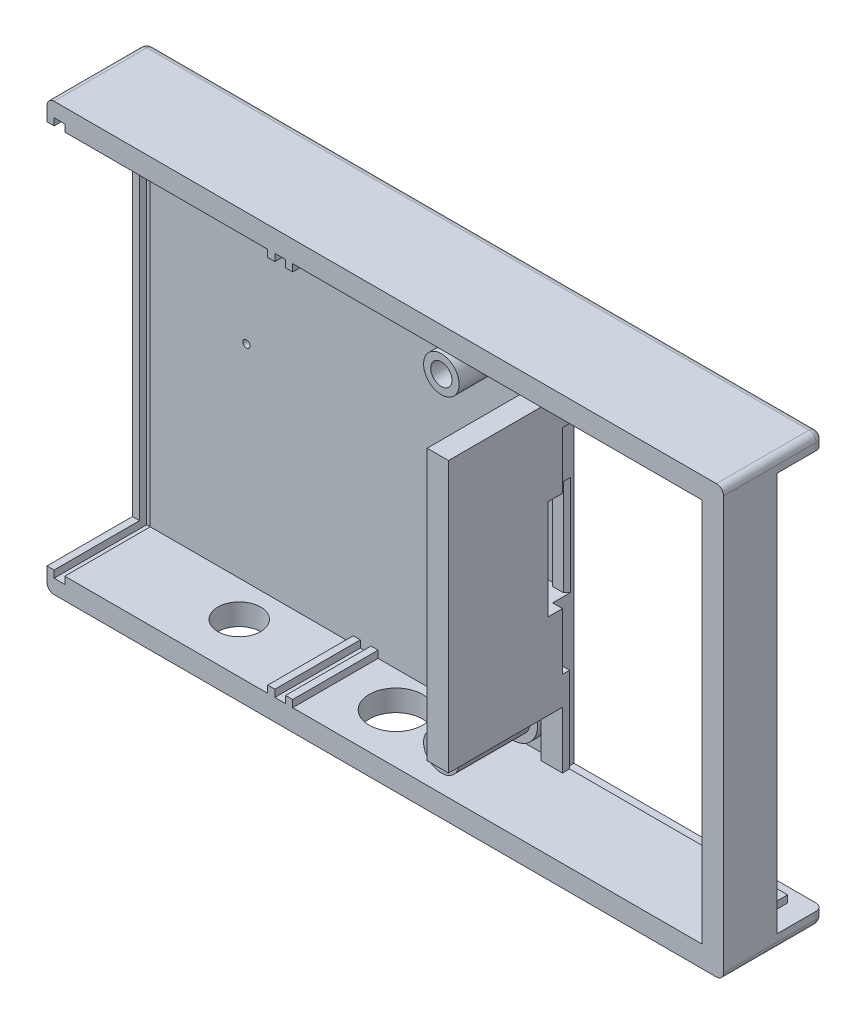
SolidWorks part; units mm, degrees
ref_plane "Plan1" through (0, 0, 0) normal (0, 0, 1) x (1, 0, 0)
ref_plane "Plan2" through (0, 0, 0) normal (0, 1, 0) x (1, 0, 0)
ref_plane "Plan3" through (0, 0, 0) normal (1, 0, 0) x (0, 0, -1)
sketch "Esquisse1" plane through (0, 0, 0) normal (0, 0, 1) x (1, 0, 0)
  line L1 (-60, 40) -> (35, 40)
  line L2 (-60, 40) -> (-60, -20)
  line L3 (-60, -20) -> (35, -20)
  line L4 (35, 40) -> (35, -20)
  dimension "D1" = 95
  dimension "D2" = 60
extrude "Base-Extrusion" add sketch "Esquisse1" along normal blind 14
sketch "Esquisse2" plane through (0, 0, 14) normal (0, 0, 1) x (1, 0, 0)
  line L0 (35, 40) -> (-60, 40) construction
  line L1 (-57, 37) -> (32, 37)
  line L2 (-57, 37) -> (-57, -17)
  line L3 (-57, -17) -> (32, -17)
  line L4 (32, 37) -> (32, -17)
  line L5 (-60, -20) -> (35, -20) construction
  line L6 (-60, 40) -> (-60, -20) construction
  line L7 (35, -20) -> (35, 40) construction
  dimension "D1" = 89
  dimension "D2" = 3
  dimension "D3" = 3
  dimension "D4" = 3
  dimension "D5" = 3
  dimension "D6" = 3
extrude "Enlèv. mat.-Extru.1" cut sketch "Esquisse2" against normal blind 12
sketch "Esquisse3" plane through (0, 0, 14) normal (0, 0, 1) x (1, 0, 0)
  line L0 (35, -20) -> (35, 40) construction
  line L1 (32, -17) -> (35, -17)
  line L2 (32, -17) -> (32, 37)
  line L3 (32, 37) -> (35, 37)
  line L4 (35, -17) -> (35, 37)
  dimension "D1" = 54
  dimension "D2" = 3
extrude "Enlèv. mat.-Extru.2" cut sketch "Esquisse3" against normal blind 12
sketch "Esquisse4" plane through (0, 0, 2) normal (0, 0, 1) x (1, 0, 0)
  line L0 (35, 37) -> (-57, 37) construction
  line L1 (0, 37) -> (32, 37)
  line L2 (0, 37) -> (0, -17)
  line L3 (0, -17) -> (32, -17)
  line L4 (32, 37) -> (32, -17)
  line L5 (35, -17) -> (35, 37) construction
  dimension "D1" = 3
  dimension "D2" = 32
extrude "Enlèv. mat.-Extru.3" cut sketch "Esquisse4" against normal through all
sketch "Esquisse12" plane through (0, 0, 0) normal (0, 0, -1) x (-1, 0, 0)
  line L1 (0, 37) -> (-2, 37)
  line L2 (0, 37) -> (0, 38)
  line L3 (0, 38) -> (-2, 38)
  line L4 (-2, 37) -> (-2, 38)
  dimension "D1" = 1
extrude "Enlèv. mat.-Extru.7" cut sketch "Esquisse12" against normal blind 2
sketch "Esquisse14" plane through (0, 0, 0) normal (0, 0, -1) x (-1, 0, 0)
  line L0 (-35, -20) -> (-35, 40) construction
  line L1 (-32, -17) -> (-35, -17)
  line L2 (-32, -17) -> (-32, 38)
  line L3 (-32, 38) -> (-35, 38)
  line L4 (-35, -17) -> (-35, 38)
extrude "Enlèv. mat.-Extru.8" cut sketch "Esquisse14" against normal blind 6.5
sketch "Esquisse15" plane through (0, 0, 0) normal (0, 0, -1) x (-1, 0, 0)
  line L1 (0, -17) -> (-32, -17)
  line L2 (0, -17) -> (0, -18)
  line L3 (0, -18) -> (-32, -18)
  line L4 (-32, -17) -> (-32, -18)
  dimension "D1" = 1
extrude "Enlèv. mat.-Extru.9" cut sketch "Esquisse15" against normal blind 2
sketch "Esquisse16" plane through (0, 0, 0) normal (0, 0, -1) x (-1, 0, 0)
  line L1 (-32, -18) -> (-35, -18)
  line L2 (-32, -18) -> (-32, -17)
  line L3 (-32, -17) -> (-35, -17)
  line L4 (-35, -18) -> (-35, -17)
  dimension "D1" = 1
extrude "Enlèv. mat.-Extru.10" cut sketch "Esquisse16" against normal blind 6.5
sketch "Esquisse19" plane through (0, 0, 2) normal (0, 0, 1) x (1, 0, 0)
  line L0 (35, 37) -> (-57, 37) construction
  line L1 (1.3816, -17) -> (-1.6184, -17)
  line L2 (1.3816, -17) -> (1.3816, 37)
  line L3 (1.3816, 37) -> (-1.6184, 37)
  line L4 (-1.6184, -17) -> (-1.6184, 37)
  dimension "D1" = 54
  dimension "D2" = 3
extrude "Boss.-Extru.17" add sketch "Esquisse19" along normal blind 17
sketch "Esquisse20" plane through (0, 0, 19) normal (0, 0, 1) x (1, 0, 0)
  line L0 (-1.6184, 37) -> (-1.6184, -17) construction
  line L1 (1.3816, -17) -> (-1.6184, -17)
  line L2 (1.3816, -17) -> (1.3816, -9.0031)
  line L3 (1.3816, -9.0031) -> (-1.6184, -9.0031)
  line L4 (-1.6184, -17) -> (-1.6184, -9.0031)
  line L5 (1.3816, -17) -> (1.3816, 37) construction
  line L6 (-1.6184, 37) -> (1.3816, 37)
  line L7 (-1.6184, 37) -> (-1.6184, 29.0017)
  line L8 (-1.6184, 29.0017) -> (1.3816, 29.0017)
  line L9 (1.3816, 37) -> (1.3816, 29.0017)
extrude "Enlèv. mat.-Extru.11" cut sketch "Esquisse20" against normal blind 16
sketch "Esquisse21" plane through (0, 0, 0) normal (0, 0, -1) x (-1, 0, 0)
  line L1 (-2, 38) -> (-32, 38)
  line L2 (-2, 38) -> (-2, 37)
  line L3 (-2, 37) -> (-32, 37)
  line L4 (-32, 38) -> (-32, 37)
extrude "Enlèv. mat.-Extru.12" cut sketch "Esquisse21" against normal blind 2
sketch "Esquisse22" plane through (0, 37, 0) normal (0, -1, 0) x (1, 0, 0)
  line L0 (35, 14) -> (35, 0) construction
  line L1 (35, 6.5) -> (32, 6.5)
  line L2 (35, 6.5) -> (35, 14)
  line L3 (35, 14) -> (32, 14)
  line L4 (32, 6.5) -> (32, 14)
  line L5 (35, 14) -> (-57, 14) construction
extrude "Boss.-Extru.18" add sketch "Esquisse22" along normal blind 54
sketch "Esquisse23" plane through (0, 0, 2) normal (0, 0, -1) x (-1, 0, 0)
  line L0 (-1.3816, -17) -> (-1.3816, 37) construction
  line L1 (-1.3816, -5) -> (0, -5)
  line L2 (-1.3816, -5) -> (-1.3816, 25)
  line L3 (-1.3816, 25) -> (0, 25)
  line L4 (0, -5) -> (0, 25)
  line L5 (0, 38) -> (0, -18) construction
  line L6 (-35, -18) -> (0, -18) construction
  line L7 (0, 38) -> (-35, 38) construction
  dimension "D1" = 13
  dimension "D2" = 13
extrude "Enlèv. mat.-Extru.13" cut sketch "Esquisse23" against normal blind 1
sketch "Esquisse24" plane through (0, 0, 3) normal (0, 0, -1) x (-1, 0, 0)
  line L0 (-1.3816, 25) -> (-1.3816, -5) construction
  line L1 (-1.3816, 3) -> (0, 3)
  line L2 (-1.3816, 3) -> (-1.3816, 17)
  line L3 (-1.3816, 17) -> (0, 17)
  line L4 (0, 3) -> (0, 17)
  line L5 (0, -5) -> (0, 25) construction
  dimension "D1" = 8
  dimension "D2" = 8
  dimension "D3" = 14
extrude "Enlèv. mat.-Extru.14" cut sketch "Esquisse24" against normal blind 2
sketch "Esquisse25" plane through (0, 0, 0) normal (1, 0, 0) x (0, 0, -1)
  line L1 (-5, 3) -> (-1, 3)
  line L2 (-5, 3) -> (-5, 17)
  line L3 (-5, 17) -> (-1, 17)
  line L4 (-1, 3) -> (-1, 17)
  dimension "D1" = 4
extrude "Enlèv. mat.-Extru.16" cut sketch "Esquisse25" against normal blind 6
chamfer "Chanfrein3" distance 0.5 angle 45
sketch "Esquisse26" plane through (0, 0, 1) normal (0, 0, 1) x (1, 0, 0)
  line L0 (-6, 3) -> (-0.5, 3) construction
  line L1 (-4.5, 3) -> (-2, 3)
  line L2 (-4.5, 3) -> (-4.5, 17)
  line L3 (-4.5, 17) -> (-2, 17)
  line L4 (-2, 3) -> (-2, 17)
  line L5 (-0.5, 3) -> (-0.5, 17) construction
  dimension "D1" = 1.5
  dimension "D2" = 2.5
extrude "Enlèv. mat.-Extru.18" cut sketch "Esquisse26" against normal blind 0.5
sketch "Esquisse31" plane through (0, 0, 1) normal (0, 0, 1) x (1, 0, 0)
  line L1 (-6, 17) -> (-4.5, 17)
  line L2 (-6, 17) -> (-6, 3)
  line L3 (-6, 3) -> (-4.5, 3)
  line L4 (-4.5, 17) -> (-4.5, 3)
extrude "Boss.-Extru.20" add sketch "Esquisse31" along normal blind 1
chamfer "Chanfrein6" distance 1 angle 45
sketch "Esquisse33" plane through (0, 0, 2) normal (0, 0, 1) x (1, 0, 0)
  line L0 (1.3816, -9.0031) -> (1.3816, 29.0017) construction
  line L1 (-57, -17) -> (-1.6184, -17) construction
  line L2 (32, 37) -> (-57, 37) construction
  circle A0 centre (-5.6184, -13) radius 3.5
  circle A1 centre (-5.6184, 33) radius 3.5
  dimension "D2" = 7
  dimension "D6" = 7
  dimension "D1" = 7
  dimension "D3" = 4
  dimension "D4" = 4
  dimension "D5" = 7
extrude "Boss.-Extru.21" add sketch "Esquisse33" along normal blind 1
sketch "Esquisse34" plane through (0, 0, 3) normal (0, 0, 1) x (1, 0, 0)
  circle A0 centre (-5.6184, -13) radius 2.5
  dimension "D1" = 5
extrude "Boss.-Extru.23" add sketch "Esquisse34" along normal blind 10
sketch "Esquisse35" plane through (0, 0, 13) normal (0, 0, 1) x (1, 0, 0)
  circle A0 centre (-5.6184, -13) radius 1.5
  dimension "D1" = 3
extrude "Enlèv. mat.-Extru.19" cut sketch "Esquisse35" against normal through all
sketch "Esquisse36" plane through (0, 0, 3) normal (0, 0, 1) x (1, 0, 0)
  circle A0 centre (-5.6184, 33) radius 2.5
  dimension "D1" = 5
extrude "Boss.-Extru.24" add sketch "Esquisse36" along normal blind 10
sketch "Esquisse37" plane through (0, 0, 13) normal (0, 0, 1) x (1, 0, 0)
  circle A0 centre (-5.6184, 33) radius 1.5
  dimension "D1" = 3
extrude "Enlèv. mat.-Extru.21" cut sketch "Esquisse37" against normal through all
sketch "Esquisse38" plane through (0, 0, 0) normal (0, 0, -1) x (-1, 0, 0)
  circle A0 centre (5.6184, -13) radius 2.5
  circle A1 centre (5.6184, 33) radius 2.5
  dimension "D1" = 5
  dimension "D2" = 5
extrude "Enlèv. mat.-Extru.22" cut sketch "Esquisse38" against normal blind 2
sketch "Esquisse40" plane through (-57, 0, 0) normal (1, 0, 0) x (0, 0, -1)
  line L1 (-2, 37) -> (-14, 37)
  line L2 (-2, 37) -> (-2, -17)
  line L3 (-2, -17) -> (-14, -17)
  line L4 (-14, 37) -> (-14, -17)
extrude "Enlèv. mat.-Extru.23" cut sketch "Esquisse40" against normal through all
fillet "Congé1" radius 1
fillet "Congé2" radius 1
fillet "Congé3" radius 1
fillet "Congé4" radius 1
fillet "Congé5" radius 1
sketch "Esquisse41" plane through (0, 0, 2) normal (0, 0, 1) x (1, 0, 0)
  line L0 (-1.6184, 37) -> (-60, 37) construction
  line L1 (-59, 37) -> (-57.5, 37)
  line L2 (-59, 37) -> (-59, -17)
  line L3 (-59, -17) -> (-57.5, -17)
  line L4 (-57.5, 37) -> (-57.5, -17)
  line L5 (-60, -17) -> (-60, 37) construction
  dimension "D1" = 1.5
  dimension "D2" = 1
extrude "Enlèv. mat.-Extru.24" cut sketch "Esquisse41" against normal blind 1
sketch "Esquisse42" plane through (0, -17, 0) normal (0, 1, 0) x (-1, 0, 0)
  line L0 (60, 14) -> (-32, 14) construction
  line L1 (59, 1) -> (57.5, 1)
  line L2 (59, 1) -> (59, 14)
  line L3 (59, 14) -> (57.5, 14)
  line L4 (57.5, 1) -> (57.5, 14)
extrude "Enlèv. mat.-Extru.25" cut sketch "Esquisse42" against normal blind 1
sketch "Esquisse43" plane through (0, 37, 0) normal (0, -1, 0) x (1, 0, 0)
  line L0 (32, 14) -> (-60, 14) construction
  line L1 (-59, 1) -> (-57.5, 1)
  line L2 (-59, 1) -> (-59, 14)
  line L3 (-59, 14) -> (-57.5, 14)
  line L4 (-57.5, 1) -> (-57.5, 14)
extrude "Enlèv. mat.-Extru.26" cut sketch "Esquisse43" against normal blind 1
sketch "Esquisse47" plane through (0, 37, 0) normal (0, -1, 0) x (1, 0, 0)
  line L0 (-1.6184, 2) -> (-57.5, 2) construction
  line L1 (-28, 2) -> (-29, 2)
  line L2 (-28, 2) -> (-28, 14)
  line L3 (-28, 14) -> (-29, 14)
  line L4 (-29, 2) -> (-29, 14)
  line L5 (32, 14) -> (-57.5, 14) construction
  line L6 (-60, 2) -> (-60, 14) construction
  line L8 (-26.5, 2) -> (-25.5, 2)
  line L9 (-26.5, 2) -> (-26.5, 14)
  line L10 (-26.5, 14) -> (-25.5, 14)
  line L11 (-25.5, 2) -> (-25.5, 14)
  dimension "D1" = 1
  dimension "D2" = 31
  dimension "D3" = 1
  dimension "D4" = 1.5
extrude "Boss.-Extru.25" add sketch "Esquisse47" along normal blind 1
sketch "Esquisse48" plane through (0, -17, 0) normal (0, 1, 0) x (-1, 0, 0)
  line L0 (57.5, 14) -> (-32, 14) construction
  line L1 (25.5, 14) -> (26.5, 14)
  line L2 (25.5, 14) -> (25.5, 2)
  line L3 (25.5, 2) -> (26.5, 2)
  line L4 (26.5, 14) -> (26.5, 2)
  line L5 (57.5, 2) -> (1.6184, 2) construction
  line L6 (60, 14) -> (60, 2) construction
  line L7 (28, 2) -> (29, 2)
  line L8 (28, 2) -> (28, 14)
  line L9 (28, 14) -> (29, 14)
  line L10 (29, 2) -> (29, 14)
  dimension "D1" = 1
  dimension "D2" = 1
  dimension "D3" = 1.5
  dimension "D4" = 31
extrude "Boss.-Extru.26" add sketch "Esquisse48" along normal blind 1
sketch "Esquisse49" plane through (0, 0, 0) normal (0, 0, -1) x (-1, 0, 0)
  line L1 (59, 39) -> (-34, 39) construction
  line L2 (59, -19) -> (59, 39) construction
  circle A0 centre (44, 12) radius 0.5
  circle A1 centre (44, 27) radius 0.5
  dimension "D1" = 15
  dimension "D2" = 12
  dimension "D3" = 15
extrude "Enlèv. mat.-Extru.27" cut sketch "Esquisse49" against normal through all
sketch "Esquisse50" plane through (0, -20, 0) normal (0, -1, 0) x (1, 0, 0)
  line L0 (-59, 14) -> (34, 14) construction
  line L1 (-60, 1) -> (-60, 14) construction
  circle A0 centre (-18, 7.0029) radius 3.75
  dimension "D1" = 7.5
  dimension "D2" = 6.9971
  dimension "D3" = 42
extrude "Enlèv. mat.-Extru.29" cut sketch "Esquisse50" against normal up to next
sketch "Esquisse51" plane through (0, -20, 0) normal (0, -1, 0) x (1, 0, 0)
  line L0 (-59, 14) -> (34, 14) construction
  line L1 (-59, 14) -> (-59, 1) construction
  circle A0 centre (-40, 7) radius 3
  dimension "D1" = 6
  dimension "D2" = 7
  dimension "D3" = 19
extrude "Enlèv. mat.-Extru.30" cut sketch "Esquisse51" against normal up to next
